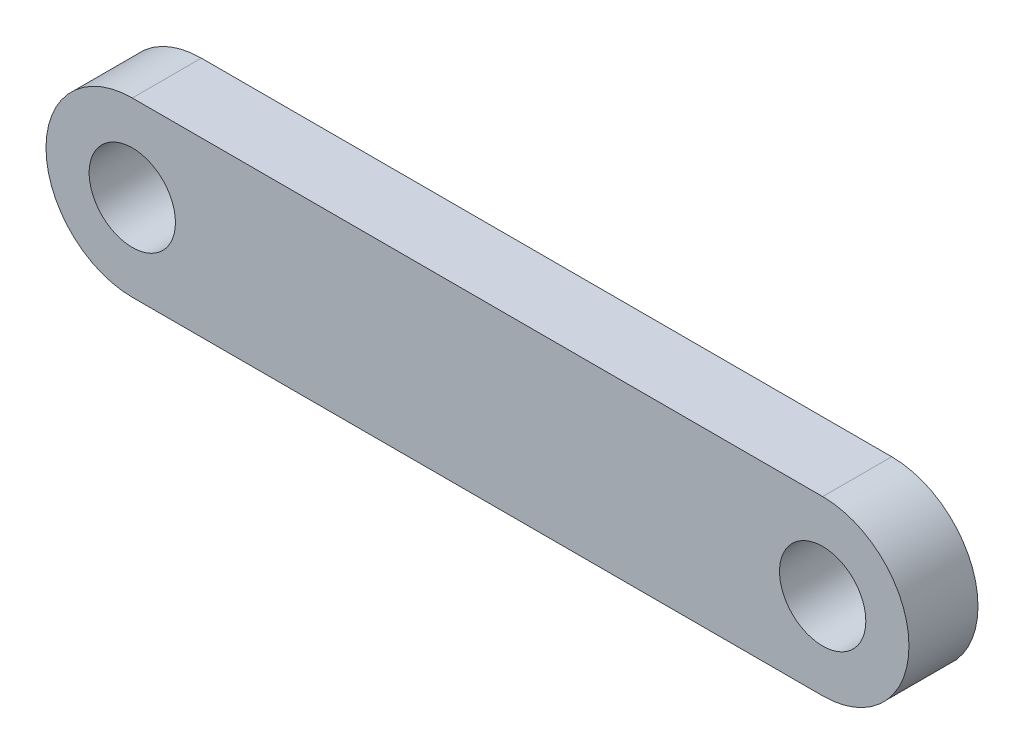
SolidWorks part; units mm, degrees
ref_plane "Front Plane" through (0, 0, 0) normal (0, 0, 1) x (1, 0, 0)
ref_plane "Top Plane" through (0, 0, 0) normal (0, 1, 0) x (1, 0, 0)
ref_plane "Right Plane" through (0, 0, 0) normal (1, 0, 0) x (0, 0, -1)
sketch "Sketch1" plane through (0, 0, 0) normal (0, 0, 1) x (1, 0, 0)
  line L0 (0, 0) -> (40, 0)
  line L1 (40, -10) -> (0, -10)
  arc A0 (40, 0) -> (40, -10) centre (40, -5) cw
  arc A1 (0, -10) -> (0, 0) centre (0, -5) cw
  circle A2 centre (0, -5) radius 2.5
  circle A3 centre (40, -5) radius 2.5
  dimension "D1" = 5
  dimension "D2" = 5
  dimension "D3" = 40
extrude "Extrude2" add sketch "Sketch1" along normal mid plane 4
